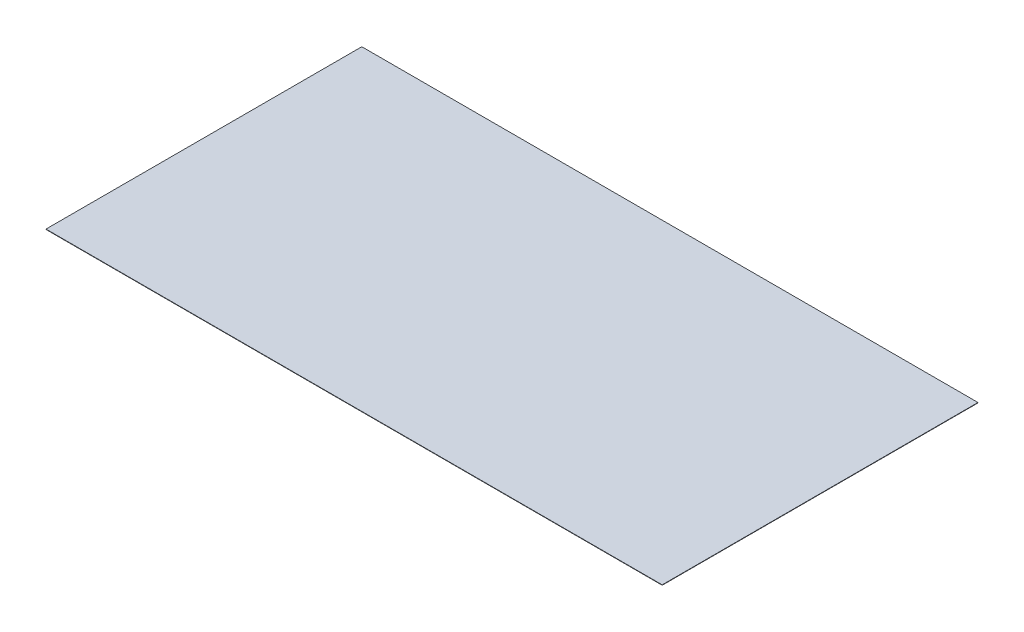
SolidWorks part; units mm, degrees
ref_plane "Front Plane" through (0, 0, 0) normal (0, 0, 1) x (1, 0, 0)
ref_plane "Top Plane" through (0, 0, 0) normal (0, 1, 0) x (1, 0, 0)
ref_plane "Right Plane" through (0, 0, 0) normal (1, 0, 0) x (0, 0, -1)
sketch "Sketch1" plane through (0, 0, 0) normal (0, 1, 0) x (1, 0, 0)
  line L1 (0, 0) -> (80, 0)
  line L2 (0, 0) -> (0, 41)
  line L3 (0, 41) -> (80, 41)
  line L4 (80, 0) -> (80, 41)
  dimension "D1" = 41
  dimension "D2" = 80
extrude "Boss-Extrude1" add sketch "Sketch1" along normal blind 0.05
